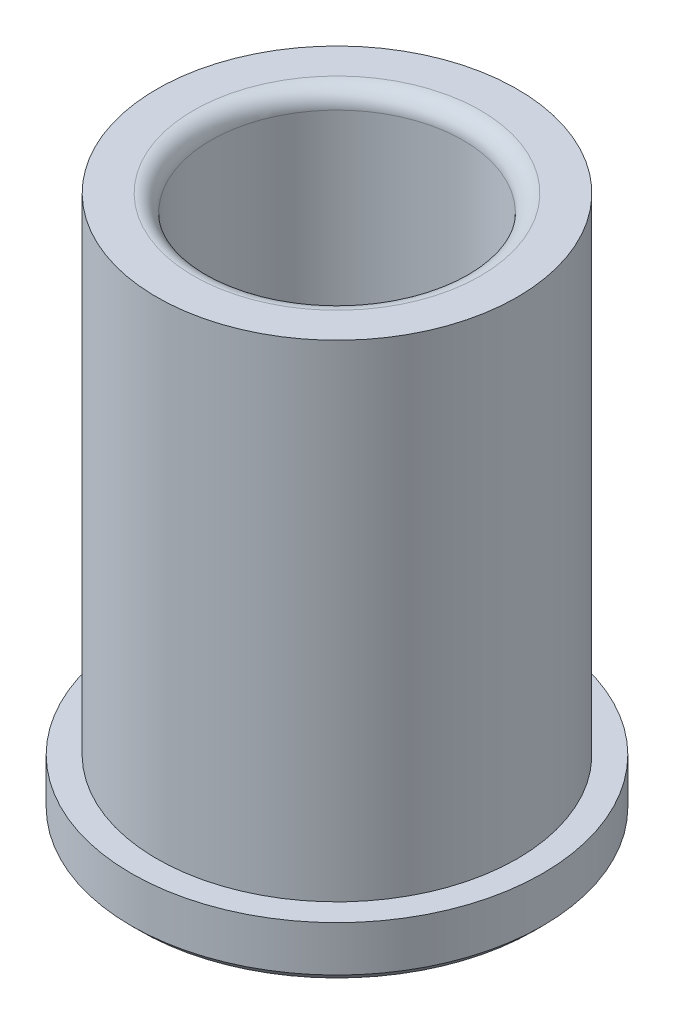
SolidWorks part; units mm, degrees
ref_plane "Front Plane" through (0, 0, 0) normal (0, 0, 1) x (1, 0, 0)
ref_plane "Top Plane" through (0, 0, 0) normal (0, 1, 0) x (1, 0, 0)
ref_plane "Right Plane" through (0, 0, 0) normal (1, 0, 0) x (0, 0, -1)
sketch "Sketch1" plane through (0, 0, 0) normal (0, 0, 1) x (1, 0, 0)
  line L0 (-17.3609, 0) -> (-18.1229, 0.762)
  line L1 (0, -1000) -> (0, 49000) construction
  line L2 (-11.1189, 47.625) -> (-11.1188, 0.762)
  line L3 (-11.8808, 0) -> (-17.3609, 0)
  line L4 (-18.1229, 0.762) -> (-18.1229, 4.7625)
  line L5 (-18.1229, 4.7625) -> (-15.8813, 4.7625)
  line L6 (-15.8813, 47.625) -> (-15.8813, 4.7625)
  line L7 (-15.8813, 47.625) -> (-11.1189, 47.625)
  line L8 (-11.8808, 0) -> (-11.1188, 0.762)
  dimension "OD" = 31.7627
  dimension "ID" = 22.2377
  dimension "H" = 36.2458
  dimension "D2" = 45
  dimension "OVERALL LENGTH" = 47.625
  dimension "D4" = 0.762
  dimension "D5" = 135
  dimension "T" = 4.7625
revolve "Revolve1" add sketch "Sketch1" angle 360 about L1
fillet "Fillet1" radius 1.524 1 edges at (11.1188, 47.625, 0)
